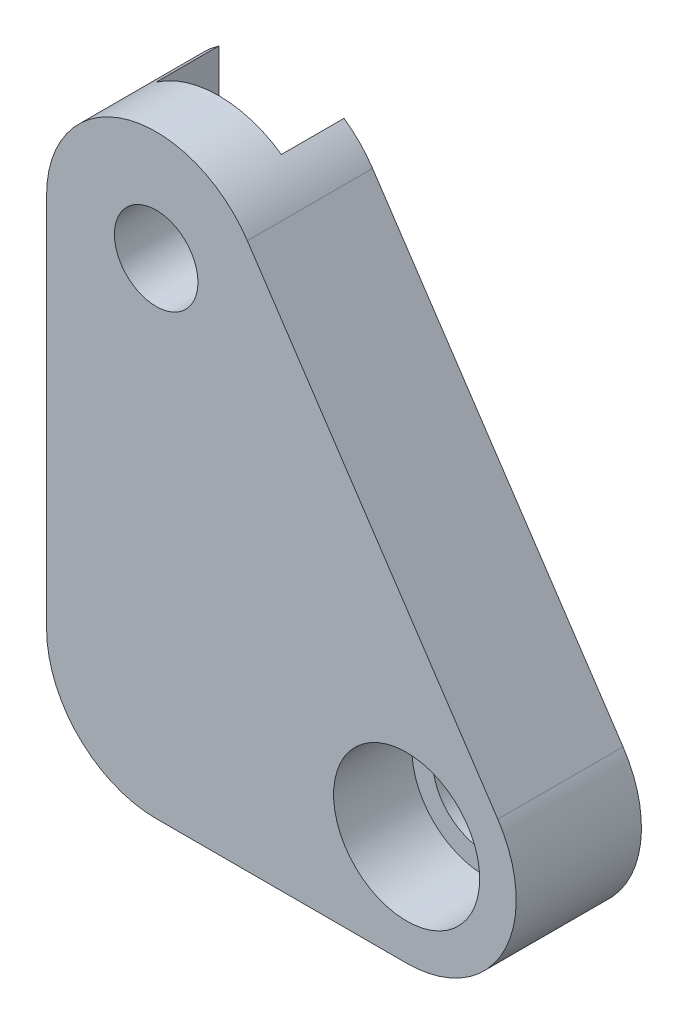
SolidWorks part; units mm, degrees
ref_plane "Plan de face" through (0, 0, 0) normal (0, 0, 1) x (1, 0, 0)
ref_plane "Plan de dessus" through (0, 0, 0) normal (0, 1, 0) x (1, 0, 0)
ref_plane "Plan de droite" through (0, 0, 0) normal (1, 0, 0) x (0, 0, -1)
ref_plane "Plan4" through (0, 0, 6) normal (0, 0, -1) x (-1, 0, 0)
sketch "Esquisse1" plane through (0, 0, 6) normal (0, 0, -1) x (-1, 0, 0)
  line L0 (31.05, -21) -> (31.05, 72)
  line L1 (-7.423, 83.6487) -> (-55.423, 11.6487)
  line L2 (-37.95, -21) -> (31.05, -21)
  arc A0 (31.05, 72) -> (-7.423, 83.6487) centre (10.05, 72) ccw
  arc A1 (-55.423, 11.6487) -> (-37.95, -21) centre (-37.95, 0) ccw
extrude "Extrusion1" add sketch "Esquisse1" against normal blind 24
sketch "Esquisse2" plane through (0, -21, 0) normal (0, -1, 0) x (1, 0, 0)
  line L0 (-22.05, 6) -> (1.95, 6)
  line L1 (1.95, 6) -> (1.95, 18)
  line L2 (1.95, 18) -> (-22.05, 18)
  line L3 (-22.05, 18) -> (-22.05, 6)
extrude "Enlèv. mat.-Extru.1" cut sketch "Esquisse2" against normal up to next
hole_wizard "Diamètre du perçage M16.0 (16)1" positions "Esquisse4" profile "Esquisse3" hole size "M16.0" standard "Ansi Métrique"
sketch "Esquisse4" plane through (0, 0, 18) normal (0, 0, -1) x (-1, 0, 0)
  point P0 (10.05, 72)
sketch "Esquisse3" plane through (-10.05, 72, 18) normal (1, 0, 0) x (0, 1, 0)
  line L0 (0, 0) -> (0, 12)
  line L1 (0, 12) -> (8, 12)
  line L2 (8, 12) -> (8, 0)
  line L5 (8, 0) -> (0, 0)
  line L11 (0, -6.35) -> (0, 107.95) construction
  dimension "Diamètre du perçage jusqu'au prochain" = 16
  dimension "Profondeur du perçage jusqu'au prochain" = 12
hole_wizard "Perçage1" positions "Esquisse6" profile "Esquisse5" legacy
sketch "Esquisse6" plane through (0, 0, 30) normal (0, 0, 1) x (1, 0, 0)
  point P0 (37.95, 0)
sketch "Esquisse5" plane through (37.95, 0, 30) normal (1, 0, 0) x (0, -1, 0)
  line L0 (0, 0) -> (0, 24)
  line L1 (0, 24) -> (10, 24)
  line L2 (10, 24) -> (10, 15)
  line L3 (10, 15) -> (14, 15)
  line L4 (14, 15) -> (14, 0)
  line L5 (14, 0) -> (0, 0)
  line L6 (0, 110) -> (0, -10) construction
  dimension "Diamètre" = 20
  dimension "Profondeur" = 24
  dimension "Diamètre chambrage" = 28
  dimension "Profondeur chambrage" = 15
fillet "Congé1" radius 21 1 edges at (-31.05, -21, 18)
